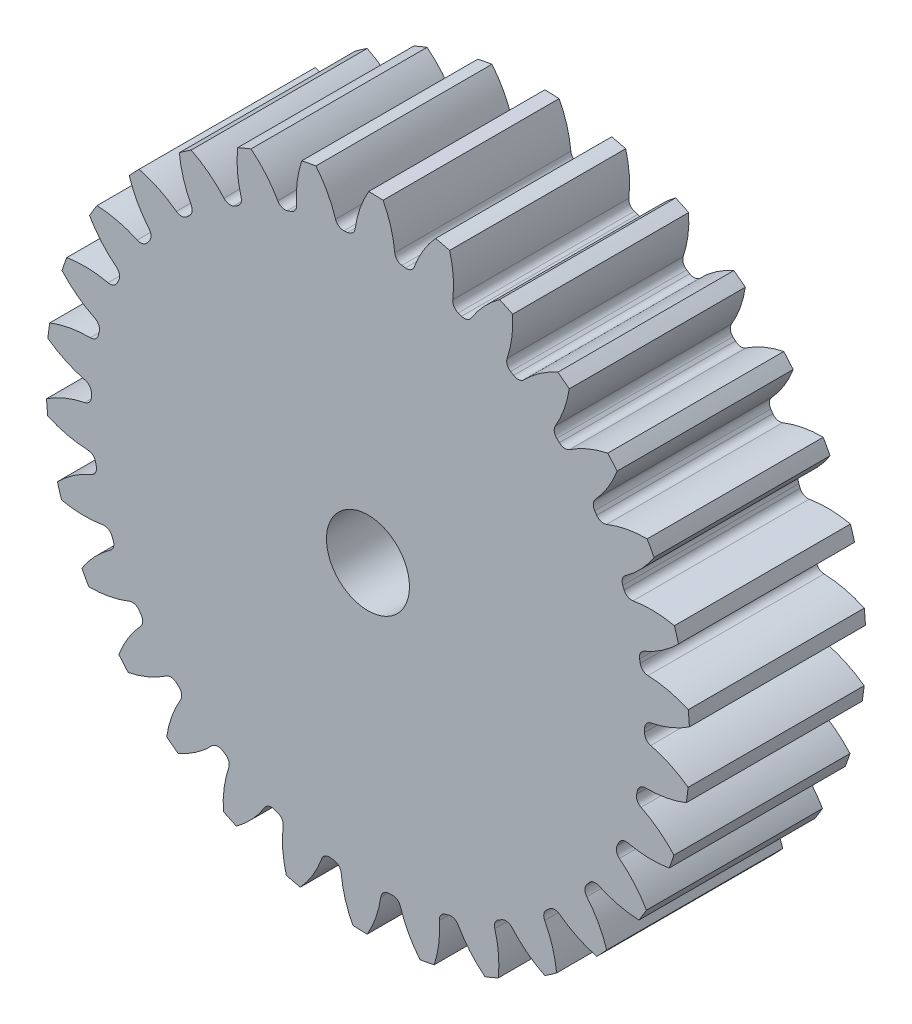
SolidWorks part; units mm, degrees
ref_plane "Front" through (0, 0, 0) normal (0, 0, 1) x (1, 0, 0)
ref_plane "Top" through (0, 0, 0) normal (0, 1, 0) x (1, 0, 0)
ref_plane "Right" through (0, 0, 0) normal (1, 0, 0) x (0, 0, -1)
sketch "Sketch3" plane through (0, 0, 0) normal (0, 0, 1) x (1, 0, 0)
  circle A0 centre (0, 0) radius 162.56
  dimension "od" = 325.12
extrude "gearBody" add sketch "Sketch3" along normal blind 88.9
sketch "Sketch2" plane through (0, 0, 0) normal (0, 0, 1) x (1, 0, 0)
  line L0 (0, 0) -> (132.308, 54.8038) construction
  line L1 (161.8912, -17.5573) -> (0, 0) construction
  line L2 (0, 0) -> (36.3143, 0) construction
  line L3 (152.3423, 4.1938) -> (151.9502, -11.7) construction
  line L5 (152.1463, -3.7531) -> (0, 0) construction
  line L7 (0, 0) -> (143.2092, 0) construction
  arc A0 (143.2016, 1.4739) -> (142.9547, -8.5327) centre (0, 0) ccw construction
  arc A1 (162.2895, 9.3741) -> (161.6299, -17.3645) centre (0, 0) ccw construction
  arc A2 (152.3423, 4.1938) -> (151.9502, -11.7) centre (0, 0) ccw construction
  arc A3 (139.6325, -4.3437) -> (139.6768, -2.5463) centre (0, 0) ccw
  arc A4 (161.8912, -17.5573) -> (142.7545, -8.4818) centre (129.4449, -61.2606) ccw
  arc A5 (161.8912, -17.5573) -> (162.56, 9.5538) centre (0, 0) ccw
  arc A6 (162.56, 9.5538) -> (142.999, 1.4329) centre (132.308, 54.8038) cw
  arc A7 (139.6768, -2.5463) -> (142.999, 1.4329) centre (143.8112, -2.6217) cw
  arc A8 (142.7545, -8.4818) -> (139.6325, -4.3437) centre (143.7656, -4.4722) cw
  point P6 (162.56, 9.5538)
  point P22 (161.8912, -17.5573)
  dimension "baseDia" = 286.4183
  dimension "od" = 325.12
  dimension "pd" = 304.8
  dimension "rd" = 279.4
  dimension "rFillet" = 4.1351
  dimension "pointX" = 162.56
  dimension "pointY" = 9.5538
  dimension "CTT" = 15.8937
  dimension "flankCenterAngle" = 22.5
extrude "toothCut" cut sketch "Sketch2" along normal through all
pattern_circular "CirPattern1" count 30 over 360 about axis through (0, 0, 0) along (0, 0, 1) of "toothCut"
sketch "hub1Dia" plane through (0, 0, 0) normal (0, 0, -1) x (-1, 0, 0)
  circle A0 centre (0, 0) radius 12.7
  dimension "hub1Dia" = 25.4
sketch "hub2Dia" plane through (0, 0, 88.9) normal (0, 0, 1) x (1, 0, 0)
  circle A0 centre (0, 0) radius 12.7
  dimension "hub2dia" = 25.4
sketch "boreDia" plane through (0, 0, 0) normal (0, 0, 1) x (1, 0, 0)
  circle A0 centre (0, 0) radius 20.955
  dimension "boreDia" = 41.91
extrude "bore" cut sketch "boreDia" against normal mid plane 25400
